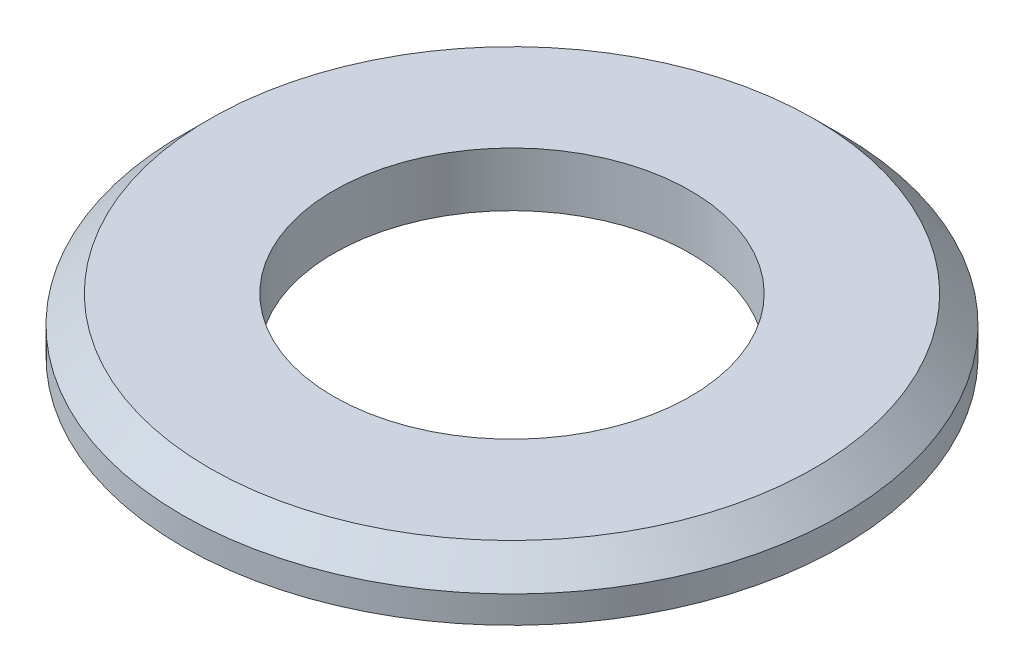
SolidWorks part; units mm, degrees
ref_plane "Front" through (0, 0, 0) normal (0, 0, 1) x (1, 0, 0)
ref_plane "Top" through (0, 0, 0) normal (0, 1, 0) x (1, 0, 0)
ref_plane "Right" through (0, 0, 0) normal (1, 0, 0) x (0, 0, -1)
sketch "Sketch1" plane through (0, 0, 0) normal (0, 1, 0) x (1, 0, 0)
  circle A0 centre (0, 0) radius 23
  circle A1 centre (0, 0) radius 42.5
extrude "Extrude1" add sketch "Sketch1" along normal blind 7
chamfer "Chamfer1" distance 3.5 1 edges at (0, 7, 42.5)
